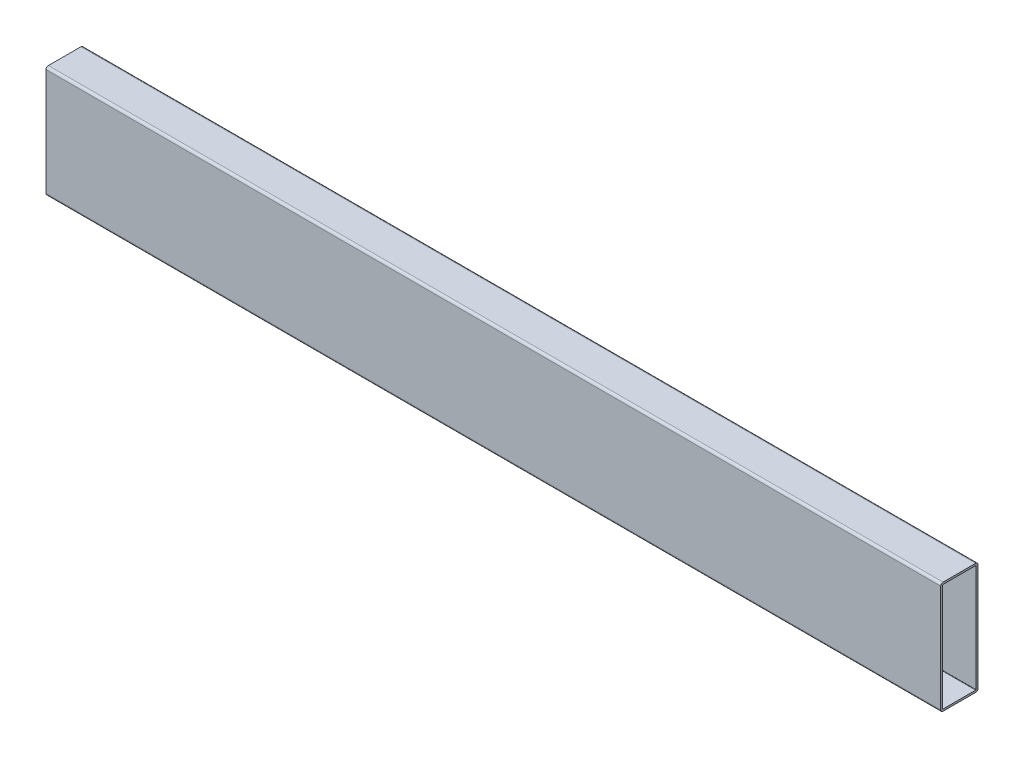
SolidWorks part; units mm, degrees
ref_plane "Front Plane" through (0, 0, 0) normal (0, 0, 1) x (1, 0, 0)
ref_plane "Top Plane" through (0, 0, 0) normal (0, 1, 0) x (1, 0, 0)
ref_plane "Right Plane" through (0, 0, 0) normal (1, 0, 0) x (0, 0, -1)
sketch "Sketch1" plane through (0, 0, 0) normal (1, 0, 0) x (0, 0, -1)
  line L0 (-5.373, 3.898) -> (16.852, 3.898)
  line L1 (-5.373, 5.2442) -> (16.852, 5.2442)
  line L2 (-6.9605, 3.6567) -> (-6.9605, -69.3683)
  line L3 (-5.373, -70.9558) -> (16.852, -70.9558)
  line L4 (18.4395, 3.6567) -> (18.4395, -69.3683)
  line L5 (17.0933, 3.6567) -> (17.0933, -69.3683)
  line L6 (-5.373, -69.6096) -> (16.852, -69.6096)
  line L7 (-5.6143, 3.6567) -> (-5.6143, -69.3683)
  arc A0 (16.852, 5.2442) -> (18.4395, 3.6567) centre (16.852, 3.6567) cw
  arc A1 (-6.9605, 3.6567) -> (-5.373, 5.2442) centre (-5.373, 3.6567) cw
  arc A2 (-5.373, -70.9558) -> (-6.9605, -69.3683) centre (-5.373, -69.3683) cw
  arc A3 (18.4395, -69.3683) -> (16.852, -70.9558) centre (16.852, -69.3683) cw
  arc A4 (16.852, 3.898) -> (17.0933, 3.6567) centre (16.852, 3.6567) cw
  arc A5 (17.0933, -69.3683) -> (16.852, -69.6096) centre (16.852, -69.3683) cw
  arc A6 (-5.373, -69.6096) -> (-5.6143, -69.3683) centre (-5.373, -69.3683) cw
  arc A7 (-5.6143, 3.6567) -> (-5.373, 3.898) centre (-5.373, 3.6567) cw
  point P6 (18.4395, 5.2442)
  point P9 (-6.9605, 5.2442)
  point P14 (18.4395, -70.9558)
  dimension "D3" = 1.5875
  dimension "D1" = 25.4
  dimension "D2" = 76.2
  dimension "D4" = 1.3462
extrude "Extrude1" add sketch "Sketch1" along normal blind 609.6
